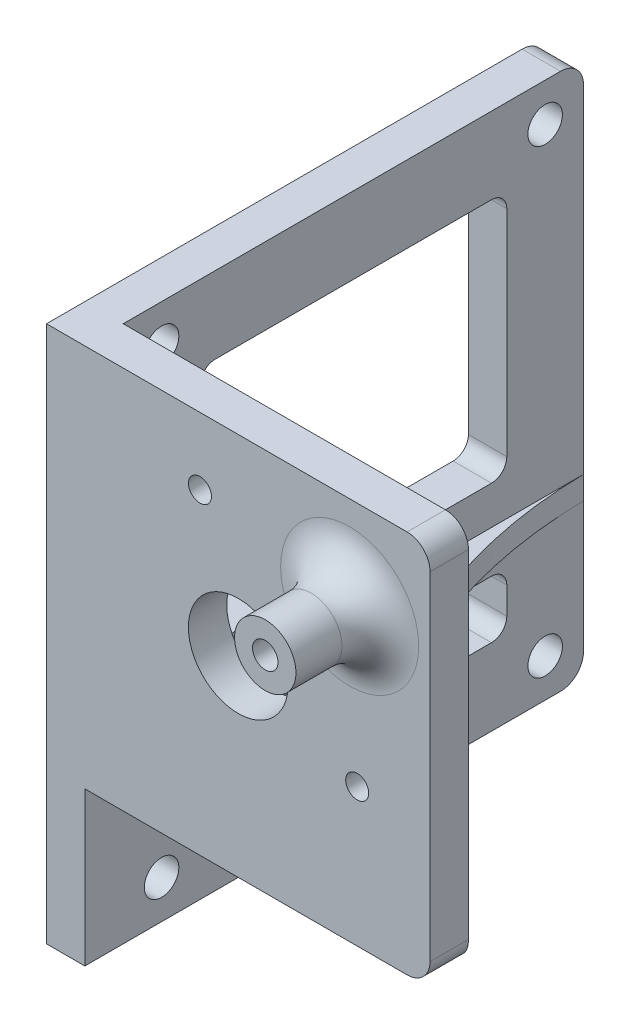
SolidWorks part; units mm, degrees
ref_plane "Front Plane" through (0, 0, 0) normal (0, 0, 1) x (1, 0, 0)
ref_plane "Top Plane" through (0, 0, 0) normal (0, 1, 0) x (1, 0, 0)
ref_plane "Right Plane" through (0, 0, 0) normal (1, 0, 0) x (0, 0, -1)
imported_body "Imported3"
sketch "Sketch1" plane through (0, 0, 0) normal (0, 0, 1) x (1, 0, 0)
  line L0 (-20, -25) -> (-20, 25)
  line L1 (-20, 25) -> (25, 25)
  line L2 (25, 25) -> (25, -25)
  line L3 (25, -25) -> (-20, -25)
extrude "Boss-Extrude1" add sketch "Sketch1" along normal blind 5
sketch "Sketch2" plane through (0, 0, 0) normal (0, 0, -1) x (-1, 0, 0)
  line L0 (20, -22) -> (-25, -22)
  line L1 (-25, -22) -> (-25, 25)
  line L2 (-25, 25) -> (20, 25)
  line L3 (20, 25) -> (20, -22)
extrude "Boss-Extrude2" add sketch "Sketch2" along normal blind 60
sketch "Sketch3" plane through (-20, 0, 0) normal (-1, 0, 0) x (0, 0, 1)
  line L0 (-60, -45) -> (-60, 25)
  line L1 (-60, 25) -> (5, 25)
  line L2 (5, 25) -> (5, -45)
  line L3 (5, -45) -> (-60, -45)
  line L4 (5, 25) -> (-60, 25) construction
  dimension "D1" = 70
extrude "Boss-Extrude3" add sketch "Sketch3" along normal blind 5
sketch "Sketch4" plane through (25, 0, 0) normal (1, 0, 0) x (0, 0, -1)
  line L0 (0, -22) -> (60, -22)
  line L1 (60, -22) -> (60, 25)
  line L2 (60, 25) -> (0, 25)
  line L3 (0, 25) -> (0, -22)
extrude "Cut-Extrude1" cut sketch "Sketch4" against normal blind 45
sketch "Sketch5" plane through (-20, 0, 0) normal (1, 0, 0) x (0, 0, -1)
  line L0 (42.5, -12) -> (42.5, 15)
  line L1 (42.5, 15) -> (17.5, 15)
  line L2 (17.5, 15) -> (17.5, -12)
  line L3 (17.5, -12) -> (42.5, -12)
extrude "Cut-Extrude2" [suppressed] cut sketch "Sketch5" against normal through all
sketch "Sketch6" plane through (-20, 0, 0) normal (1, 0, 0) x (0, 0, -1)
  line L0 (51.5, -10) -> (51.5, 15)
  line L1 (47.5, 15) -> (47.5, -10)
  arc A0 (47.5, -10) -> (51.5, -10) centre (49.5, -10) ccw
  arc A1 (51.5, 15) -> (47.5, 15) centre (49.5, 15) ccw
extrude "Cut-Extrude3" [suppressed] cut sketch "Sketch6" against normal through all
sketch "Sketch7" plane through (0, -22, 0) normal (0, 1, 0) x (-1, 0, 0)
  line L0 (18, -23.1127) -> (18, -2)
  line L1 (18, -2) -> (-1.2003, -2)
  arc A0 (-1.2003, -2) -> (-2.2704, -5.6897) centre (-1.2003, -4) ccw
  arc A1 (-2.2704, -5.6897) -> (14.2073, -23.9994) centre (-26.6698, -44.217) cw
  arc A2 (14.2073, -23.9994) -> (18, -23.1127) centre (16, -23.1127) ccw
extrude "Cut-Extrude4" cut sketch "Sketch7" against normal through all
sketch "Sketch8" plane through (-25, 0, 0) normal (-1, 0, 0) x (0, 0, 1)
  line L0 (-7.5, -10) -> (-7.5, 15)
  line L1 (-11.5, 15) -> (-11.5, -10)
  arc A0 (-11.5, -10) -> (-7.5, -10) centre (-9.5, -10) ccw
  arc A1 (-7.5, 15) -> (-11.5, 15) centre (-9.5, 15) ccw
extrude "Cut-Extrude5" [suppressed] cut sketch "Sketch8" against normal through all
sketch "Sketch9" plane through (0, 0, 5) normal (0, 0, 1) x (1, 0, 0)
  circle A0 centre (14.5161, 12.8487) radius 4
  dimension "D1" = 8
extrude "Boss-Extrude4" add sketch "Sketch9" along normal blind 11
ref_plane "Plane1" through (0, 12.8487, 0) normal (0, -1, 0) x (1, 0, 0)
sketch "Sketch10" plane through (0, 12.8487, 0) normal (0, -1, 0) x (1, 0, 0)
  line L0 (16.1779, 16) -> (14.5161, 16)
  line L1 (14.5161, 16) -> (14.5161, 0)
  line L2 (14.5161, 0) -> (16.1661, 0)
  line L3 (16.1661, 0) -> (16.1661, 5)
  line L4 (16.1661, 5) -> (16.1779, 5)
  line L5 (16.1779, 5) -> (16.1779, 16)
  line L6 (14.5161, 16) -> (14.5161, 0) construction
revolve "Cut-Revolve1" cut sketch "Sketch10" angle 360 about L6
hole_wizard "Ø13.0 (13) Diameter Hole1" positions "Sketch12" profile "Sketch11" hole size "Ø13.0" standard "Ansi Metric"
sketch "Sketch12" plane through (0, 0, 0) normal (0, 0, -1) x (-1, 0, 0)
  point P0 (0, 0)
sketch "Sketch11" plane through (0, 0, 0) normal (1, 0, 0) x (0, 1, 0)
  line L0 (0, 0) -> (0, 16)
  line L1 (0, 16) -> (6.5, 16)
  line L2 (6.5, 16) -> (6.5, 0)
  line L5 (6.5, 0) -> (0, 0)
  line L11 (0, -6.35) -> (0, 107.95) construction
  dimension "Thru Hole Dia." = 13
  dimension "Thru Hole Depth" = 16
hole_wizard "Ø3.0 (3) Diameter Hole1" positions "Sketch14" profile "Sketch13" hole size "Ø3.0" standard "Ansi Metric"
sketch "Sketch14" plane through (0, 0, 0) normal (0, 0, -1) x (-1, 0, 0)
  point P0 (4.997, 16.2567)
  point P1 (-15.5, -7)
sketch "Sketch13" plane through (-4.997, 16.2567, 0) normal (1, 0, 0) x (0, 1, 0)
  line L0 (0, 0) -> (0, 16)
  line L1 (0, 16) -> (1.5, 16)
  line L2 (1.5, 16) -> (1.5, 0)
  line L5 (1.5, 0) -> (0, 0)
  line L11 (0, -6.35) -> (0, 107.95) construction
  dimension "Thru Hole Dia." = 3
  dimension "Thru Hole Depth" = 16
fillet "Fillet2" radius 2 1 edges at (-18, -23.5, -2)
fillet "Fillet3" radius 3 4 edges at (-22.5, -45, -60) (25, 25, 2.5) (-22.5, 25, -60) (25, -25, 2.5)
fillet "Fillet4" [suppressed] radius 4
fillet "Fillet5" radius 5 1 edges at (10.5161, 12.8487, 5)
sketch "Sketch15" plane through (-20, 0, 0) normal (1, 0, 0) x (0, 0, -1)
  line L0 (57, 25) -> (0, 25) construction
  line L1 (5, 20) -> (55, 20)
  line L2 (5, 20) -> (5, -40)
  line L3 (5, -40) -> (55, -40)
  line L4 (55, 20) -> (55, -40)
  line L5 (60, -22) -> (60, 22) construction
  circle A0 centre (5, 20) radius 2.25 construction
  circle A1 centre (55, 20) radius 2.25 construction
  circle A2 centre (55, -40) radius 2.25 construction
  circle A3 centre (5, -40) radius 2.25 construction
  circle A4 centre (5, 20) radius 4
  dimension "D1" = 4.5
  dimension "D2" = 50
  dimension "D5" = 8
  dimension "D3" = 60
  dimension "D4" = 5
  dimension "D6" = 5
hole_wizard "M4 Clearance Hole1" positions "Sketch17" profile "Sketch18" hole size "M4" standard "Ansi Metric"
sketch "Sketch17" plane through (-20, 0, 0) normal (1, 0, 0) x (0, 0, -1)
  point P0 (5, 20)
  point P1 (55, 20)
  point P3 (55, -40)
  point P5 (5, -40)
sketch "Sketch18" plane through (-20, 20, -5) normal (0, 1, 0) x (0, 0, -1)
  line L0 (0, 0) -> (0, 16.3519)
  line L1 (0, 16.3519) -> (2.25, 15)
  line L2 (2.25, 15) -> (2.25, 0)
  line L5 (2.25, 0) -> (0, 0)
  line L10 (0, 16.3519) -> (-2.25, 15) construction
  line L11 (0, -6.35) -> (0, 107.95) construction
  dimension "Hole Dia." = 4.5
  dimension "Hole Depth" = 15
  dimension "Drill Angle" = 118
sketch "Sketch19" plane through (-20, 0, 0) normal (1, 0, 0) x (0, 0, -1)
  line L0 (5, 20) -> (55, 20) construction
  line L1 (10, 15) -> (50, 15)
  line L2 (10, 15) -> (10, -17)
  line L3 (10, -17) -> (50, -17)
  line L4 (50, 15) -> (50, -17)
  line L5 (10, -27.5) -> (50, -27.5)
  line L6 (10, -27.5) -> (10, -35)
  line L7 (10, -35) -> (50, -35)
  line L8 (50, -27.5) -> (50, -35)
  line L9 (0, -22) -> (60, -22) construction
  line L10 (55, 20) -> (55, -40) construction
  line L11 (5, 20) -> (5, -40) construction
  line L12 (-5, -25) -> (60, -25) construction
  line L13 (5, -40) -> (55, -40) construction
  dimension "D1" = 5
  dimension "D2" = 5
  dimension "D3" = 5
  dimension "D4" = 5
  dimension "D5" = 2.5
  dimension "D6" = 5
  dimension "D7" = 5
extrude "Cut-Extrude6" cut sketch "Sketch19" against normal through all
fillet "Fillet6" radius 2 8 edges at (-22.5, -27.5, -50) (-22.5, -35, -50) (-22.5, -35, -10) (-22.5, -27.5, -10) (-22.5, -17, -10) (-22.5, -17, -50) (-22.5, 15, -50) (-22.5, 15, -10)
